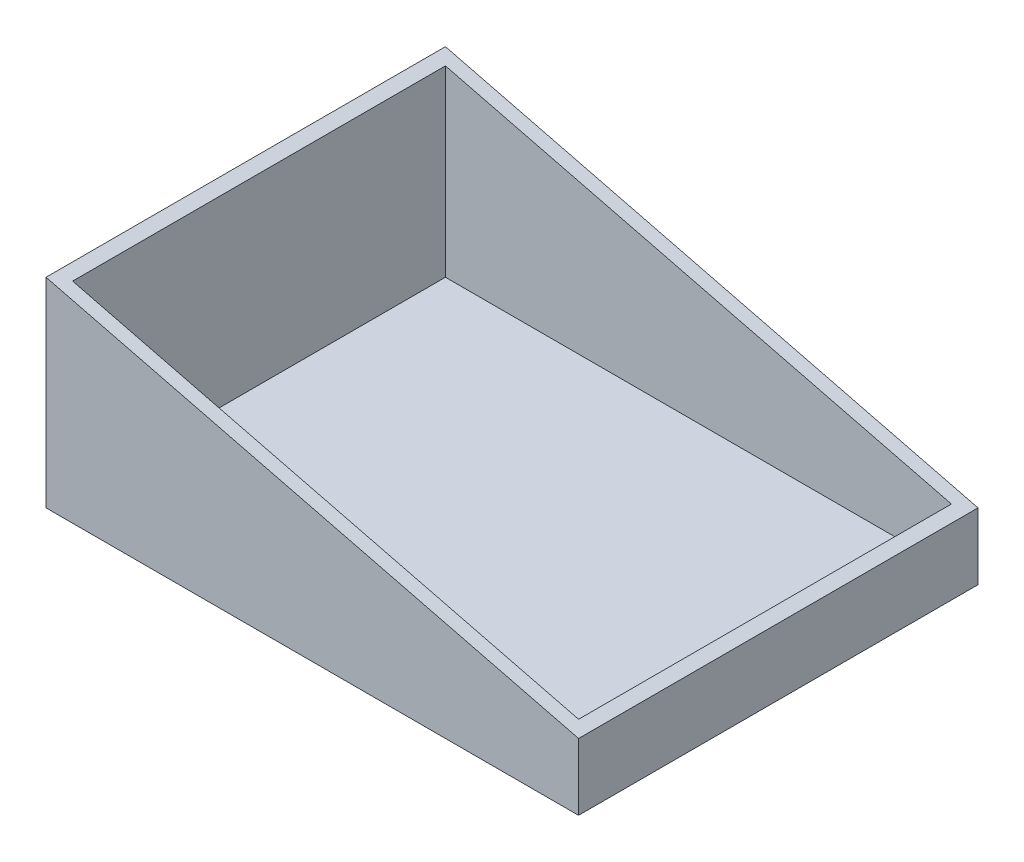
SolidWorks part; units mm, degrees
ref_plane "Front Plane" through (0, 0, 0) normal (0, 0, 1) x (1, 0, 0)
ref_plane "Top Plane" through (0, 0, 0) normal (0, 1, 0) x (1, 0, 0)
ref_plane "Right Plane" through (0, 0, 0) normal (1, 0, 0) x (0, 0, -1)
sketch "Sketch1" plane through (0, 0, 0) normal (0, 0, 1) x (1, 0, 0)
  line L0 (0, 0) -> (0, 38.1)
  line L1 (0, 38.1) -> (101.6, 12.7)
  line L2 (101.6, 12.7) -> (101.6, 0)
  line L3 (101.6, 0) -> (0, 0)
  dimension "D1" = 101.6
  dimension "D2" = 12.7
  dimension "D3" = 38.1
extrude "Extrude1" add sketch "Sketch1" against normal blind 76.2
shell "Shell1" thickness 2.54
